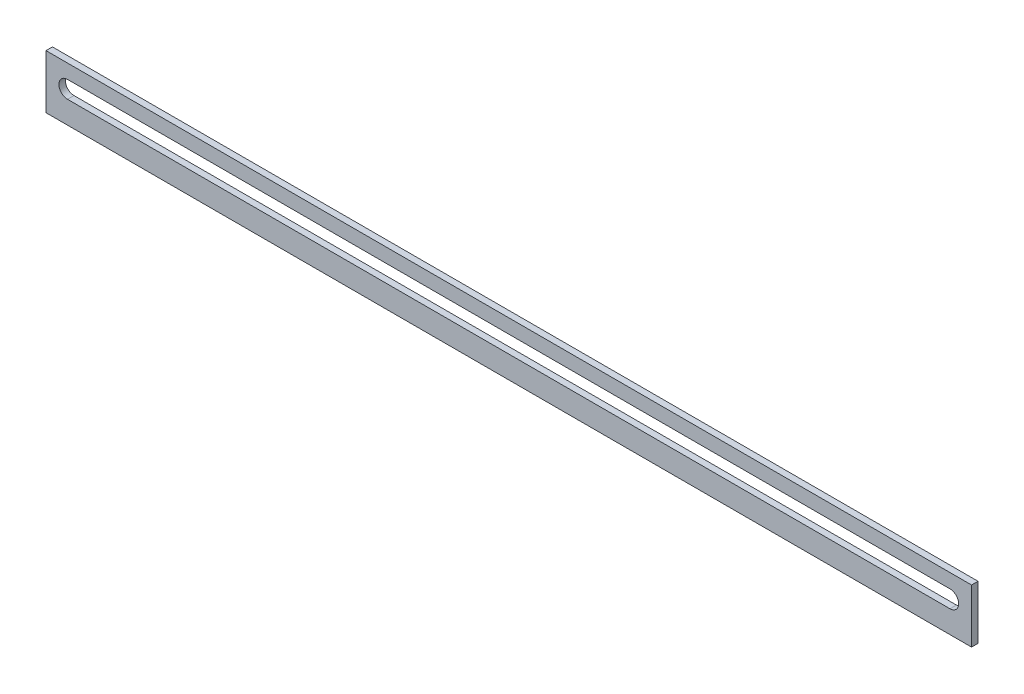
SolidWorks part; units mm, degrees
ref_plane "Plan median" through (0, 0, 0) normal (0, 0, 1) x (1, 0, 0)
ref_plane "Plan2" through (0, 0, 0) normal (0, 1, 0) x (1, 0, 0)
ref_plane "Plan3" through (0, 0, 0) normal (1, 0, 0) x (0, 0, -1)
sketch "Esquisse1" plane through (0, 0, 0) normal (0, 0, 1) x (1, 0, 0)
  line L0 (0, 0) -> (6.2832, 0) construction
  line L1 (1.4556, 4) -> (-1.4555, -3.9998)
  line L2 (1.4556, 4) -> (4.8276, 4)
  line L3 (4.8276, 4) -> (7.7387, -3.9998)
  line L4 (0, 0) -> (0, 4) construction
  line L5 (9.1671, -5) -> (9.4248, -5)
  line L6 (-2.8839, -5) -> (-3.1416, -5)
  line L7 (9.4248, -5) -> (9.4248, 7.1416)
  line L8 (-3.1416, -5) -> (-3.1416, 7.1416)
  line L9 (-3.1416, 7.1416) -> (9.4248, 7.1416)
  arc A0 (7.7387, -3.9998) -> (9.1671, -5) centre (9.1671, -3.48) ccw
  arc A1 (-2.8839, -5) -> (-1.4555, -3.9998) centre (-2.8839, -3.48) ccw
  point P14 (-1.8195, -5)
ref_plane "Plan4" through (-3.1416, 0, 0) normal (1, 0, 0) x (0, 0, -1)
sketch "Section Cremaillere" plane through (-3.1416, 0, 0) normal (1, 0, 0) x (0, 0, -1)
  line L1 (-1.5, 7.1416) -> (1.5, 7.1416)
  line L2 (-1.5, 7.1416) -> (-1.5, -9.42)
  line L3 (-1.5, -9.42) -> (1.5, -9.42)
  line L4 (1.5, 7.1416) -> (1.5, -9.42)
  line L5 (0, -9.42) -> (0, 7.1416) construction
  line L6 (0, 50) -> (0, -50) construction
  dimension "L" = 3
  dimension "h" = 9.42
extrude "Base-Extrusion" add sketch "Section Cremaillere" along normal blind 376.9911
extrude "Enlèv. mat.-Extru.2" cut sketch "Esquisse1" against normal through all and the other way blind 100
pattern_linear "Répétition linéaire1" count 30 spacing 12.5664 along (1, 0, 0) of "Enlèv. mat.-Extru.2"
sketch "Esquisse2" plane through (-3.1416, 0, 0) normal (-1, 0, 0) x (0, 0, 1)
  line L0 (0, 0) -> (-1.5, 0)
  line L1 (0, 0) -> (1.5, 0)
  line L2 (-1.5, -5) -> (1.5, -5) construction
  line L3 (-1.5, -5) -> (1.5, -5)
  line L4 (-1.5, 7.1416) -> (-1.5, -9.42) construction
  line L5 (1.5, 7.1416) -> (1.5, -9.42) construction
  line L6 (-1.5, 0) -> (-1.5, -5)
  line L7 (1.5, 0) -> (1.5, -5)
extrude "Plan primitif" [suppressed] add sketch "Esquisse2" along normal up to surface (188.4956 mm away)
sketch "Esquisse4" plane through (0, 0, 1.5) normal (0, 0, 1) x (1, 0, 0)
  line L0 (-3.1416, 0) -> (373.8495, 0)
  line L1 (-3.1416, -5) -> (-3.1416, -9.42) construction
  line L2 (373.8495, -5) -> (373.8495, -9.42) construction
sketch "Esquisse3" plane through (0, 0, 1.5) normal (0, 0, 1) x (1, 0, 0)
  line L0 (185.354, -9.42) -> (185.354, -122.0486) construction
  line L1 (373.8495, -9.42) -> (-3.1416, -9.42) construction
  line L2 (-19.646, -20) -> (390.354, -20) construction
  line L3 (-29.646, -34.42) -> (400.354, -34.42)
  line L4 (-29.646, -34.42) -> (-29.646, -9.42)
  line L5 (-29.646, -9.42) -> (400.354, -9.42)
  line L6 (400.354, -34.42) -> (400.354, -9.42)
  line L7 (-29.646, -34.42) -> (400.354, -9.42) construction
  line L8 (-29.646, -9.42) -> (400.354, -34.42) construction
  line L9 (-19.646, -16) -> (390.354, -16)
  line L10 (-19.646, -24) -> (390.354, -24)
  line L11 (-3.1416, 0) -> (373.8495, 0) construction
  arc A0 (-19.646, -16) -> (-19.646, -24) centre (-19.646, -20) ccw
  arc A1 (390.354, -24) -> (390.354, -16) centre (390.354, -20) ccw
  point P5 (185.354, -21.92)
  point P11 (185.354, -20)
  point P16 (0, 0)
  point P19 (0, 0)
  dimension "D3" = 4
  dimension "D1" = 430
  dimension "D2" = 25
  dimension "D4" = 410
  dimension "D5" = 20
extrude "Boss.-Extru.1" add sketch "Esquisse3" against normal through all
sketch "Esquisse5" plane through (0, 0, 1.5) normal (0, 0, 1) x (1, 0, 0)
  line L0 (185.354, -34.42) -> (185.354, 55.9203) construction
  line L1 (-29.646, -34.42) -> (400.354, -34.42) construction
  line L3 (-29.646, 76.5541) -> (400.354, 76.5541)
  line L4 (-29.646, 76.5541) -> (-29.646, -9.42)
  line L5 (-29.646, -9.42) -> (400.354, -9.42)
  line L6 (400.354, 76.5541) -> (400.354, -9.42)
  line L7 (-29.646, 76.5541) -> (400.354, -9.42) construction
  line L8 (-29.646, -9.42) -> (400.354, 76.5541) construction
  point P4 (185.354, 33.5671)
extrude "Enlèv. mat.-Extru.3" cut sketch "Esquisse5" against normal through all
equation "\"LD@Esquisse1\" = \"m@Esquisse1\"*1.570796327"
equation "\"FD@Esquisse1\"=\"m@Esquisse1\"*1.25"
equation "\"DLD@Esquisse1\"=\"LD@Esquisse1\"/2"
equation "\"R1@Esquisse1\"=\"m@Esquisse1\"*0.38"
equation "\"D1@Base-Extrusion\"=\"LD@Esquisse1\"*2*\"Nd@Répétition linéaire1\""
equation "\"D3@Répétition linéaire1\"=\"LD@Esquisse1\"*2"
